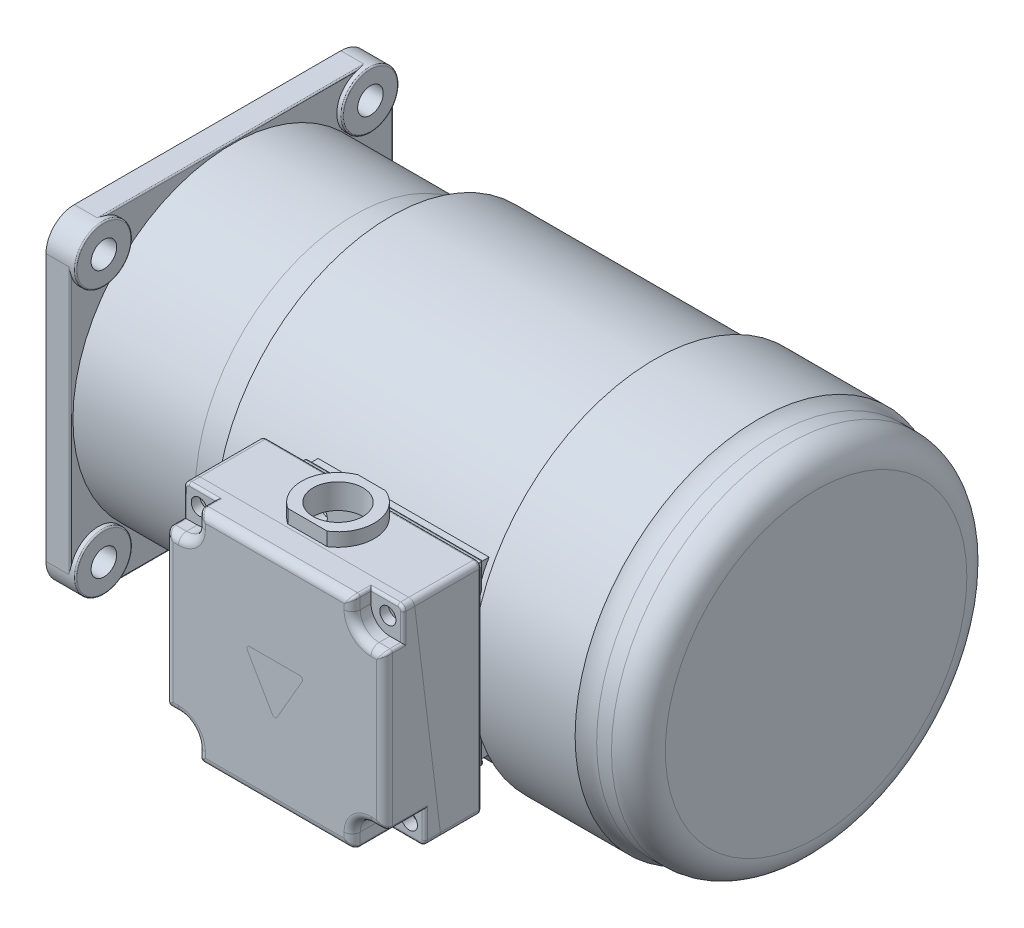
SolidWorks part; units mm, degrees
ref_plane "前视基准面" through (0, 0, 0) normal (0, 0, 1) x (1, 0, 0)
ref_plane "上视基准面" through (0, 0, 0) normal (0, 1, 0) x (1, 0, 0)
ref_plane "右视基准面" through (0, 0, 0) normal (1, 0, 0) x (0, 0, -1)
imported_body "接线盒座-1-surface1"
imported_body "接线盒座-1-surface2"
imported_body "接线盒座-1-surface3"
imported_body "接线盒座-1-surface4"
imported_body "接线盒座-1-surface5"
imported_body "接线盒座-1-surface6"
imported_body "接线盒座-1-surface7"
imported_body "接线盒盖-1-surface1"
imported_body "接线盒盖-1-surface2"
imported_body "接线盒盖-1-surface3"
imported_body "接线盒盖-1-surface4"
imported_body "15.11.08 18B立式装配体200-1-surface1"
imported_body "15.11.08 18B立式装配体200-1-surface2"
imported_body "15.11.08 18B立式装配体200-1-surface3"
imported_body "15.11.08 18B立式装配体200-1-surface4"
imported_body "15.11.08 18B立式装配体200-1-surface5"
imported_body "15.11.08 18B立式装配体200-1-surface6"
imported_body "15.11.08 18B立式装配体200-1-surface7"
imported_body "15.11.08 18B立式装配体200-1-surface8"
imported_body "GB／T1096-1979普通平键A型5×25-1-surface1"
sketch "草图1" plane through (-120.5127, 0, 0) normal (1, 0, 0) x (0, 0, -1)
  circle A0 centre (42.8283, -60.2434) radius 65
  circle A1 centre (42.8283, -76.733) radius 16.4896 construction
extrude "凸台-拉伸1" add sketch "草图1" along normal blind 98
sketch "草图2" plane through (-22.5127, 0, 0) normal (1, 0, 0) x (0, 0, -1)
  circle A0 centre (42.8283, -60.2434) radius 68
extrude "凸台-拉伸2" add sketch "草图2" along normal blind 38.5
sketch "草图3" plane through (15.9873, 0, 0) normal (1, 0, 0) x (0, 0, -1)
  circle A0 centre (42.8283, -60.2434) radius 66
extrude "凸台-拉伸3" add sketch "草图3" along normal blind 21.5
fillet "圆角1" radius 10 2 edges at (37.4873, -60.2434, -108.8283) (15.9873, -60.2434, -108.8283)
